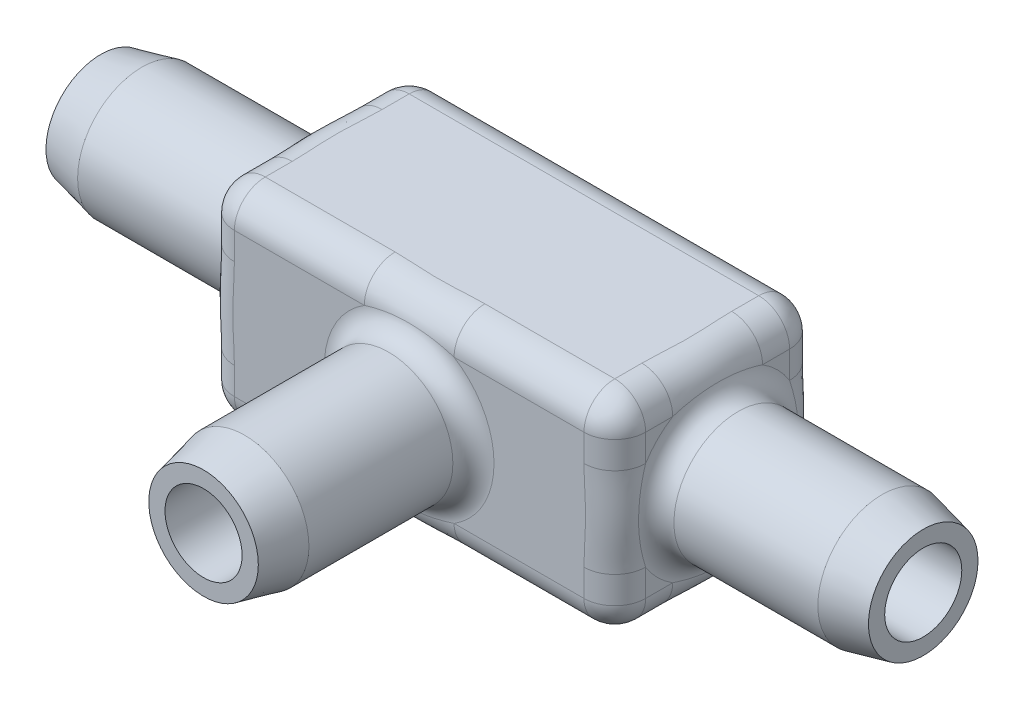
SolidWorks part; units mm, degrees
ref_plane "Plan de face" through (0, 0, 0) normal (0, 0, 1) x (1, 0, 0)
ref_plane "Plan de dessus" through (0, 0, 0) normal (0, 1, 0) x (1, 0, 0)
ref_plane "Plan de droite" through (0, 0, 0) normal (1, 0, 0) x (0, 0, -1)
sketch "Esquisse1" plane through (0, 0, 0) normal (0, 0, 1) x (1, 0, 0)
  line L1 (-20, 10) -> (20, 10)
  line L2 (-20, 10) -> (-20, -10)
  line L3 (-20, -10) -> (20, -10)
  line L4 (20, 10) -> (20, -10)
  point P4 (0, 10)
  point P6 (-20, 0)
  dimension "D1" = 20
  dimension "D2" = 40
extrude "Boss.-Extru.1" add sketch "Esquisse1" along normal blind 20
sketch "Esquisse2" plane through (0, 0, 20) normal (0, 0, 1) x (1, 0, 0)
  circle A0 centre (0, 0) radius 6.25
  circle A1 centre (0, 0) radius 3.75
  dimension "D1" = 12.5
  dimension "D2" = 7.5
extrude "Boss.-Extru.2" add sketch "Esquisse2" along normal blind 20
sketch "Esquisse20" plane through (0, 0, 20) normal (0, 0, 1) x (1, 0, 0)
  circle A0 centre (0, 0) radius 3.75
  circle A1 centre (0, 0) radius 3.75 construction
extrude "Enlèv. mat.-Extru.3" cut sketch "Esquisse20" against normal blind 12
sketch "Esquisse21" plane through (20, 0, 0) normal (1, 0, 0) x (0, 0, -1)
  line L1 (-20, 10) -> (0, 10) construction
  circle A0 centre (-10, 0) radius 6.25
  circle A1 centre (-10, 0) radius 3.75
  point P11 (-10, 10)
  dimension "D1" = 12.5
  dimension "D2" = 7.5
extrude "Boss.-Extru.3" add sketch "Esquisse21" along normal blind 20
sketch "Esquisse22" plane through (-20, 0, 0) normal (-1, 0, 0) x (0, 0, 1)
  line L1 (20, 10) -> (0, 10) construction
  circle A0 centre (10, 0) radius 6.25
  circle A1 centre (10, 0) radius 3.75
  point P13 (10, 10)
  dimension "D1" = 12.5
  dimension "D2" = 7.5
extrude "Boss.-Extru.4" add sketch "Esquisse22" along normal blind 20
fillet "Congé8" radius 2 3 edges at (6.25, 0, 20) (-20, 6.25, 10) (20, 0, 16.25)
chamfer "Chanfrein1" distance 4 angle 13 3 edges at (6.25, 0, 40) (40, 0, 3.75) (-40, -6.25, 10)
fillet "Congé10" radius 3 12 edges at (20, 0, 0) (20, 0, 20) (-20, 0, 20) (-20, 0, 0) (-20, -10, 10) (0, -10, 20) (20, -10, 10) (0, -10, 0) (20, 10, 10) (0, 10, 20) (-20, 10, 10) (0, 10, 0)
sketch "Esquisse23" plane through (20, 0, 0) normal (1, 0, 0) x (0, 0, -1)
  circle A0 centre (-10, 0) radius 4.5
  dimension "D1" = 9
extrude "Enlèv. mat.-Extru.4" cut sketch "Esquisse23" against normal up to surface (40 mm away)
fillet "Congé11" radius 7 1 edges at (3.7468, 0.1544, 14.4974)
fillet "Congé12" radius 4 2 edges at (-20, 4.5, 10) (20, 0, 5.5)
fillet "Congé13" radius 4 2 edges at (20, 0, 6.25) (-20, -3.75, 10)
